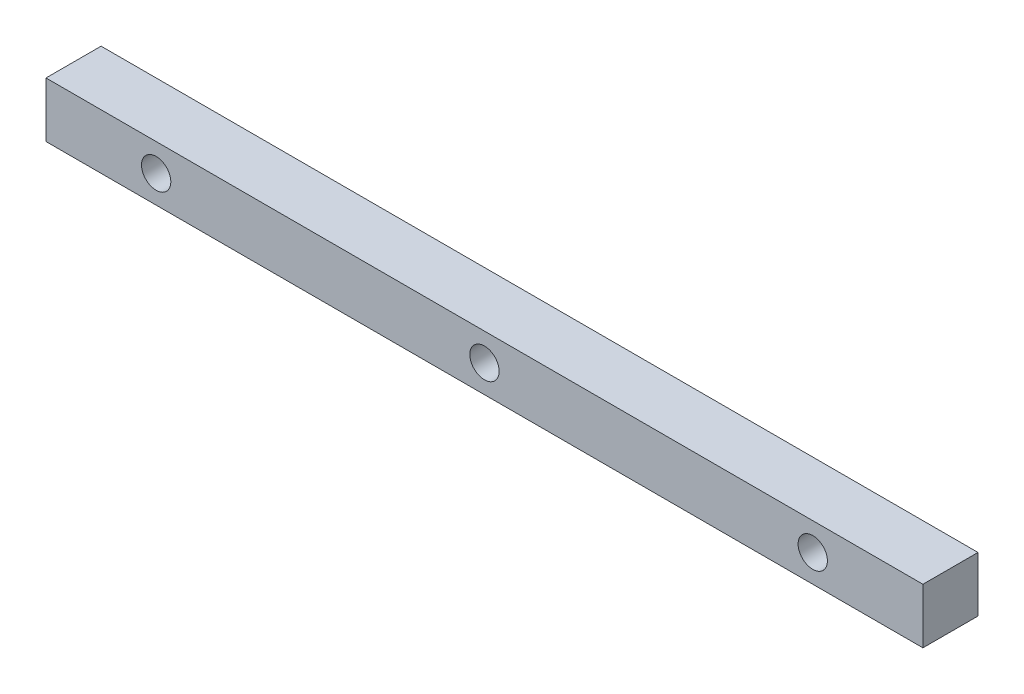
SolidWorks part; units mm, degrees
ref_plane "Front Plane" through (0, 0, 0) normal (0, 0, 1) x (1, 0, 0)
ref_plane "Top Plane" through (0, 0, 0) normal (0, 1, 0) x (1, 0, 0)
ref_plane "Right Plane" through (0, 0, 0) normal (1, 0, 0) x (0, 0, -1)
sketch "Sketch1" plane through (0, 0, 0) normal (0, 0, 1) x (1, 0, 0)
  line L0 (-202.184, 0) -> (-202.184, -381) construction
  line L1 (0, 0) -> (-202.184, 0)
  line L2 (0, 0) -> (0, -12.7)
  line L3 (0, -12.7) -> (-202.184, -12.7)
  line L4 (-202.184, 0) -> (-202.184, -12.7)
  circle A0 centre (-25.4, -6.35) radius 3.3782
  circle A1 centre (-101.092, -6.35) radius 3.3782
  circle A2 centre (-176.784, -6.35) radius 3.3782
  dimension "D2" = 6.7564
  dimension "D3" = 6.7564
  dimension "D4" = 6.7564
  dimension "D1" = 12.7
extrude "Extrude1" add sketch "Sketch1" along normal blind 12.7
